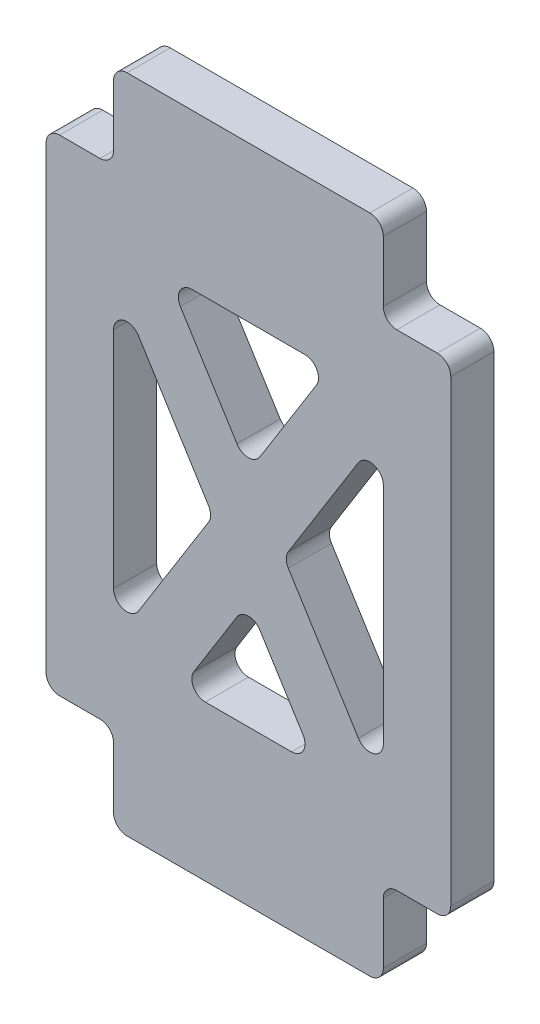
SolidWorks part; units mm, degrees
ref_plane "Front Plane" through (0, 0, 0) normal (0, 0, 1) x (1, 0, 0)
ref_plane "Top Plane" through (0, 0, 0) normal (0, 1, 0) x (1, 0, 0)
ref_plane "Right Plane" through (0, 0, 0) normal (1, 0, 0) x (0, 0, -1)
sketch "Sketch1" plane through (0, 0, 0) normal (0, 0, 1) x (1, 0, 0)
  line L1 (15, -18) -> (-15, -18)
  line L2 (15, -18) -> (15, 18)
  line L3 (15, 18) -> (-15, 18)
  line L4 (-15, -18) -> (-15, 18)
  line L5 (15, -18) -> (-15, 18) construction
  line L6 (15, 18) -> (-15, -18) construction
  point P0 (0, 0)
  dimension "D1" = 36
  dimension "D2" = 30
extrude "Boss-Extrude1" add sketch "Sketch1" along normal blind 3.2
sketch "Sketch2" plane through (0, 18, 0) normal (0, 1, 0) x (1, 0, 0)
  line L0 (15, 0) -> (-15, 0) construction
  line L1 (-10, 0) -> (10, 0)
  line L2 (-10, 0) -> (-10, -3.2)
  line L3 (-10, -3.2) -> (10, -3.2)
  line L4 (10, 0) -> (10, -3.2)
  line L5 (15, -3.2) -> (-15, -3.2) construction
  dimension "D1" = 5
  dimension "D2" = 5
extrude "Boss-Extrude2" add sketch "Sketch2" along normal blind 6.5
sketch "Sketch3" plane through (0, -18, 0) normal (0, -1, 0) x (1, 0, 0)
  line L0 (-15, 3.2) -> (15, 3.2) construction
  line L1 (-10, 3.2) -> (10, 3.2)
  line L2 (-10, 3.2) -> (-10, 0)
  line L3 (-10, 0) -> (10, 0)
  line L4 (10, 3.2) -> (10, 0)
  line L5 (-15, 0) -> (15, 0) construction
  dimension "D1" = 5
  dimension "D2" = 5
extrude "Boss-Extrude3" add sketch "Sketch3" along normal blind 6.5
fillet "Fillet1" radius 1 12 edges at (-15, -18, 1.6) (-10, -24.5, 1.6) (10, -24.5, 1.6) (15, -18, 1.6) (15, 18, 1.6) (-15, 18, 1.6) (-10, 24.5, 1.6) (10, 24.5, 1.6)
sketch "Sketch4" plane through (0, 0, 0) normal (0, 0, -1) x (-1, 0, 0)
  line L0 (-15, 17) -> (15, 17) construction
  line L1 (15, 17) -> (15, -17) construction
  line L2 (15, -17) -> (-15, -17) construction
  line L3 (-10, 19) -> (-10, -19) construction
  line L4 (10, 19) -> (10, -19) construction
  line L5 (-15, 16) -> (-7, 16) construction
  line L6 (-15, -17) -> (-15, 17) construction
  line L7 (-15, -16) -> (-7.2222, -16) construction
  line L8 (-10, 16) -> (10, -16) construction
  line L9 (10, -16) -> (10, 16) construction
  line L10 (10, 16) -> (-10, -16) construction
  line L11 (6, 13) -> (0, 3.4)
  line L12 (10, 11) -> (2.625, -0.8)
  line L13 (-6, 13) -> (0, 3.4)
  line L14 (-10, 11) -> (-2.625, -0.8)
  line L15 (-10, 11) -> (-10, -12.6)
  line L17 (10, -12.6) -> (10, 11)
  line L18 (7.2222, -16) -> (15, -16) construction
  line L19 (-2.625, -0.8) -> (-10, -12.6)
  line L20 (2.625, -0.8) -> (10, -12.6)
  line L21 (0, -5) -> (-5, -13)
  line L22 (0, -5) -> (5, -13)
  line L23 (-6, 13) -> (6, 13)
  line L24 (-5, -13) -> (5, -13)
  line L25 (7, 16) -> (15, 16) construction
  dimension "D1" = 1
  dimension "D2" = 1
  dimension "D3" = 3
  dimension "D4" = 5
  dimension "D5" = 3
  dimension "D6" = 5
  dimension "D7" = 3
  dimension "D8" = 3
extrude "Cut-Extrude1" cut sketch "Sketch4" against normal blind 10
fillet "Fillet2" radius 1 12 edges at (10, -12.6, 1.6) (10, 11, 1.6) (2.625, -0.8, 1.6) (-10, -12.6, 1.6) (-2.625, -0.8, 1.6) (-10, 11, 1.6) (-6, 13, 1.6) (0, 3.4, 1.6) (-5, -13, 1.6) (5, -13, 1.6) (0, -5, 1.6) (6, 13, 1.6)
